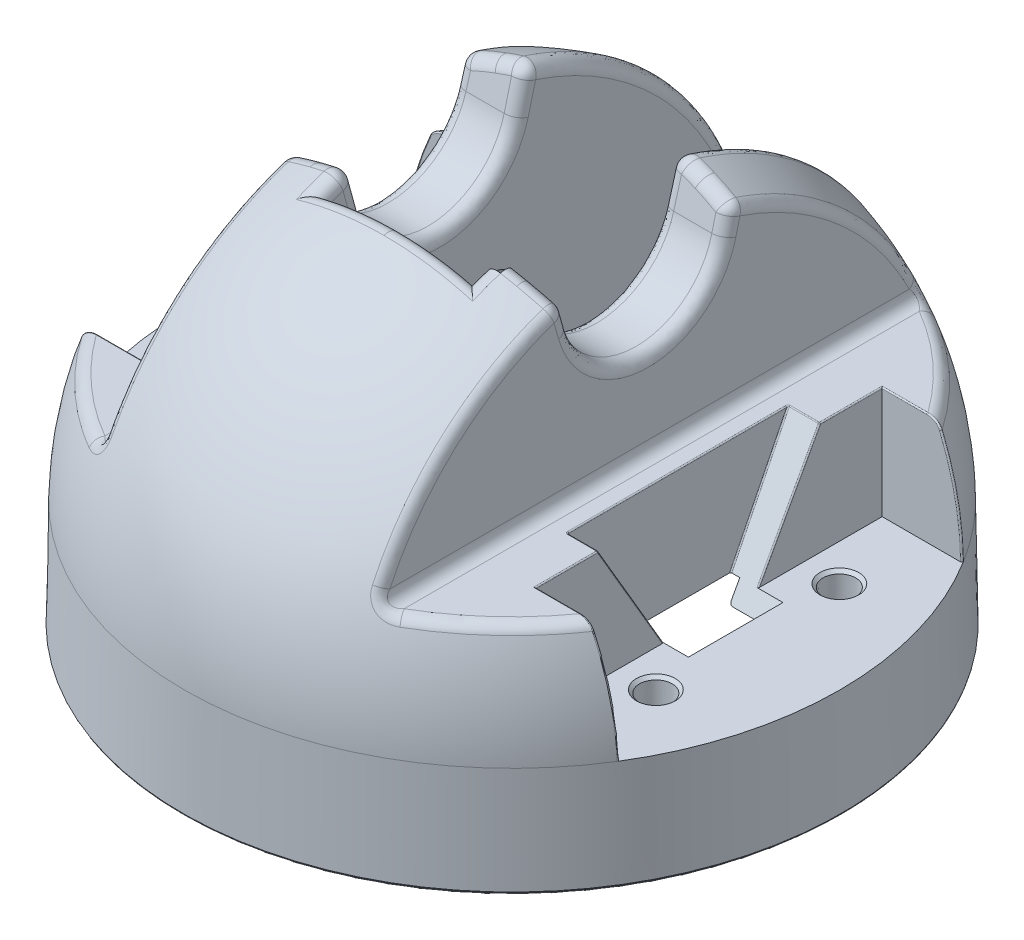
SolidWorks part; units mm, degrees
other "Solido1"
ref_plane "前视基准面" through (0, 0, 0) normal (0, 0, 1) x (1, 0, 0)
ref_plane "上视基准面" through (0, 0, 0) normal (0, 1, 0) x (1, 0, 0)
ref_plane "右视基准面" through (0, 0, 0) normal (1, 0, 0) x (0, 0, -1)
imported_body "Imported1"
other "移动面1" parameters "D1"=0.15
other "移动面2" parameters "D1"=0.15
sketch "Sketch1" plane through (0, 15, 0) normal (0, -1, 0) x (1, 0, 0)
  circle A0 centre (-5, -35.75) radius 1.15
  circle A1 centre (5, -35.75) radius 1.15
  circle A2 centre (5, 14.55) radius 1.15
  circle A3 centre (-5, 14.55) radius 1.15
  dimension "D1" = 2.3
  dimension "D2" = 2.3
  dimension "D3" = 2.3
extrude "Extrude1" cut sketch "Sketch1" against normal through all
